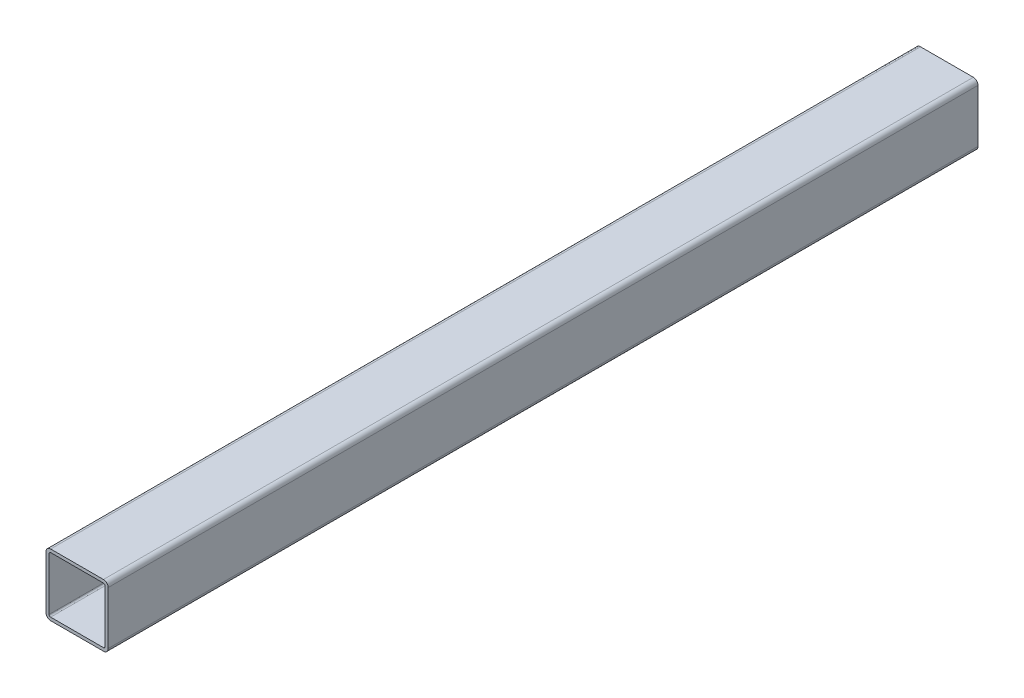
SolidWorks part; units mm, degrees
ref_plane "Plan1" through (0, 0, 0) normal (0, 0, 1) x (1, 0, 0)
ref_plane "Plan2" through (0, 0, 0) normal (0, 1, 0) x (1, 0, 0)
ref_plane "Plan3" through (0, 0, 0) normal (1, 0, 0) x (0, 0, -1)
sketch "Esquisse1" plane through (0, 0, 0) normal (0, 0, 1) x (1, 0, 0)
  line L0 (3, 2) -> (37, 2)
  line L1 (3, 0) -> (37, 0)
  line L2 (0, 3) -> (0, 37)
  line L3 (3, 40) -> (37, 40)
  line L4 (40, 3) -> (40, 37)
  line L5 (38, 3) -> (38, 37)
  line L6 (3, 38) -> (37, 38)
  line L7 (2, 3) -> (2, 37)
  arc A0 (3, 38) -> (2, 37) centre (3, 37) ccw
  arc A1 (38, 37) -> (37, 38) centre (37, 37) ccw
  arc A2 (37, 2) -> (38, 3) centre (37, 3) ccw
  arc A3 (2, 3) -> (3, 2) centre (3, 3) ccw
  arc A4 (3, 40) -> (0, 37) centre (3, 37) ccw
  arc A5 (40, 37) -> (37, 40) centre (37, 37) ccw
  arc A6 (37, 0) -> (40, 3) centre (37, 3) ccw
  arc A7 (0, 3) -> (3, 0) centre (3, 3) ccw
  point P19 (0, 40)
  point P22 (40, 40)
  point P27 (0, 0)
  dimension "D4" = 1
  dimension "D5" = 3
  dimension "D1" = 40
  dimension "D2" = 40
  dimension "D3" = 2
extrude "Extrusion1" add sketch "Esquisse1" along normal blind 560
